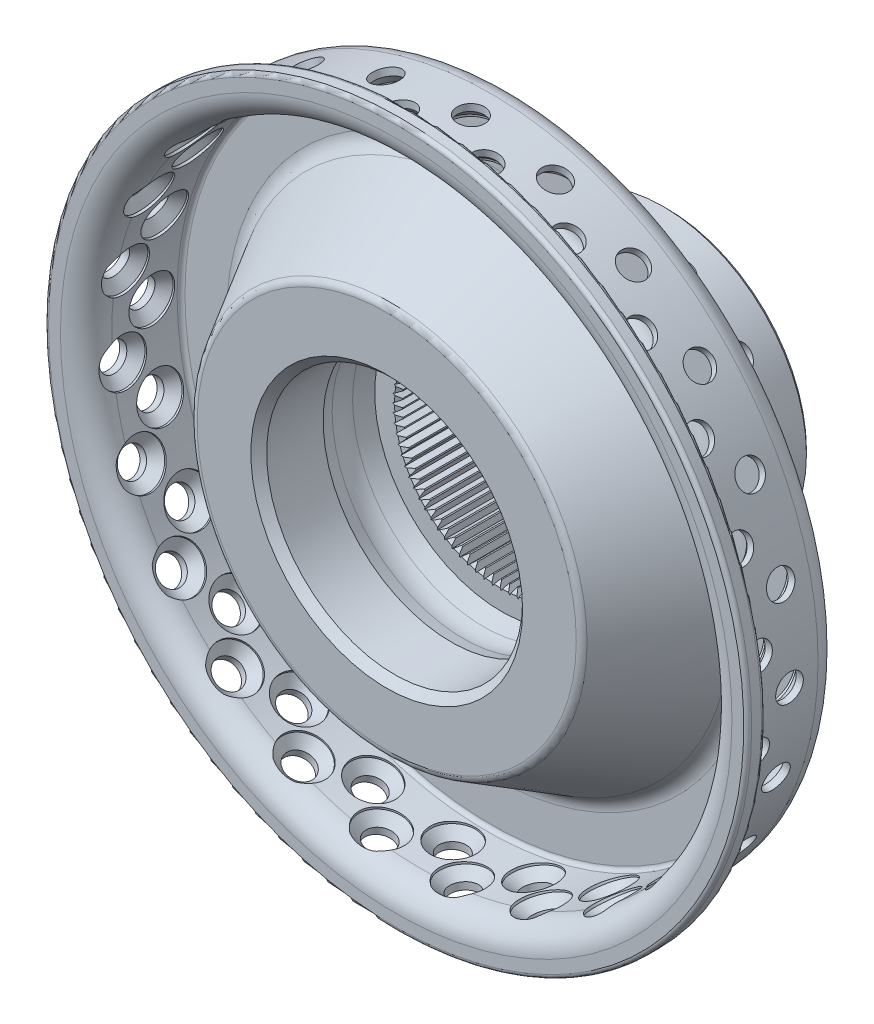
SolidWorks part; units mm, degrees
ref_plane "Front Plane" through (0, 0, 0) normal (0, 0, 1) x (1, 0, 0)
ref_plane "Top Plane" through (0, 0, 0) normal (0, 1, 0) x (1, 0, 0)
ref_plane "Right Plane" through (0, 0, 0) normal (1, 0, 0) x (0, 0, -1)
sketch "Sketch2" plane through (0, 0, 0) normal (1, 0, 0) x (0, 0, -1)
  line L0 (-177.5045, 0) -> (205.9267, 0) construction
  line L1 (0, 185.8166) -> (0, -171.8737) construction
  line L2 (-59.8625, 1430.0214) -> (709.4708, 1430.0214) construction
  line L3 (-280.1871, 421.6397) -> (-279.2316, 640.6377) construction
  line L4 (-37.5584, 109.3943) -> (-37.5584, -109.4755) construction
  dimension "D1" = 219
sketch "Sketch3" plane through (0, 0, 0) normal (1, 0, 0) x (0, 0, -1)
  line L0 (-203.3855, 0) -> (274.712, 0) construction
  line L1 (0, 34.4) -> (0, 47.9879)
  line L2 (0, 185.8166) -> (0, -171.8737) construction
  line L3 (1, 49.7199) -> (24.18, 63.1029)
  line L5 (2.4, 89) -> (2.4, 85)
  line L6 (2.4, 89) -> (6.9, 89)
  line L7 (6.9, 89) -> (6.9, 85)
  line L9 (71, 31) -> (71, 36.26)
  line L11 (0, 34.4) -> (2, 32.4)
  line L12 (2, 32.4) -> (16.3, 32.4)
  line L13 (16.3, 32.4) -> (19.4118, 33.2338)
  line L14 (24.5882, 33.2338) -> (29, 32.0517)
  line L15 (44, 31) -> (71, 31)
  line L26 (37.3465, 36.6007) -> (31.154, 38.26)
  line L28 (25.0819, 52.9193) -> (30.3911, 62.115)
  line L32 (-18.7317, 65) -> (20.4312, 65) construction
  line L33 (0, 0) -> (0, 146.5366) construction
  line L34 (71, 36.26) -> (39.9346, 36.26)
  line L35 (44, 31) -> (44, 26)
  line L36 (44, 26) -> (29, 26)
  line L37 (29, 26) -> (29, 32.0517)
  line L38 (8.9, 83) -> (26.2, 83)
  line L39 (8.9, 78.5) -> (25.43, 78.5)
  line L40 (31.7, 67) -> (31.7, 77.5)
  line L41 (26.43, 67) -> (26.43, 77.5)
  arc A0 (24.18, 63.1029) -> (26.43, 67) centre (21.93, 67) ccw
  arc A1 (30.3911, 62.115) -> (31.7, 67) centre (21.93, 67) ccw
  circle A3 centre (21.93, 67) radius 9.77 construction
  circle A4 centre (21.93, 67) radius 4.5 construction
  arc A7 (19.4118, 33.2338) -> (24.5882, 33.2338) centre (22, 23.5745) cw
  arc A16 (8.9, 83) -> (6.9, 85) centre (8.9, 85) cw
  arc A17 (8.9, 78.5) -> (2.4, 85) centre (8.9, 85) cw
  arc A18 (0, 47.9879) -> (1, 49.7199) centre (2, 47.9879) cw
  arc A19 (37.3465, 36.6007) -> (39.9346, 36.26) centre (39.9346, 46.26) ccw
  arc A20 (26.43, 77.5) -> (25.43, 78.5) centre (25.43, 77.5) ccw
  arc A21 (31.7, 77.5) -> (26.2, 83) centre (26.2, 77.5) ccw
  arc A22 (31.154, 38.26) -> (25.0819, 52.9193) centre (33.7422, 47.9193) cw
  point P16 (25.77, 89)
  point P59 (20.3034, 90.3157)
  point P67 (32.9249, 31)
  point P70 (22, 33.9273)
  point P91 (15, 45)
  point P96 (6.8759, 84.8909)
  point P100 (2.3759, 81.3909)
  point P103 (0, 49.1426)
  dimension "D10" = 166
  dimension "D11" = 9
  dimension "D52" = 2
  dimension "D53" = 6.5
  dimension "D54" = 2
  dimension "D29" = 26
  dimension "D30" = 10
  dimension "D33" = 10
  dimension "D36" = 1
  dimension "D37" = 5.5
  dimension "D6" = 31.0654
  dimension "D20" = 10
  dimension "D1" = 64.8
  dimension "D2" = 65
  dimension "D4" = 6.5543
  dimension "D7" = 22
  dimension "D8" = 2
  dimension "D9" = 178
  dimension "D12" = 2.4
  dimension "D13" = 31.7
  dimension "D14" = 4.5
  dimension "D15" = 75
  dimension "D16" = 60
  dimension "D17" = 16
  dimension "D18" = 5.27
  dimension "D19" = 45
  dimension "D22" = 62
  dimension "D23" = 15
  dimension "D24" = 15
  dimension "D27" = 5.26
  dimension "D28" = 71
  dimension "D31" = 27
  dimension "D32" = 15
  dimension "D34" = 4.5
revolve "Revolve1" add sketch "Sketch3" angle 360 about L0
fillet "Fillet3" radius 2 1 edges at (31, 0, -44)
ref_plane "Plane1" through (0, 0, -10) normal (0, 0, 1) x (1, 0, 0)
ref_plane "Plane2" through (0, 0, -18.5) normal (0, 0, 1) x (1, 0, 0)
ref_plane "Plane3" through (0, 0, -58.5) normal (0, 0, 1) x (1, 0, 0)
ref_plane "Plane4" through (0, 0, -66.3) normal (0, 0, 1) x (1, 0, 0)
sketch "Sketch4" plane through (0, 0, 0) normal (1, 0, 0) x (0, 0, -1)
  line L0 (51, 45.5009) -> (51, 21.7958) construction
  line L1 (47.5, 37.5) -> (47.5, 33.5)
  line L2 (47.5, 33.5) -> (44.5, 30.5)
  line L5 (51, 37.5) -> (47.5, 37.5)
  line L6 (44.5, 30.5) -> (44.5, 29.2972)
  line L7 (44.5, 29.2972) -> (51, 29.2972)
  line L8 (51, 29.2972) -> (51, 37.5)
  point P7 (51, 27.24)
  point P11 (51, 37.3622)
  dimension "D1" = 7
  dimension "D2" = 51
  dimension "D3" = 45
  dimension "D4" = 4
  dimension "D5" = 37.5
  dimension "D6" = 6.5
revolve "Revolve2" add sketch "Sketch4" angle 360 about L0
move or copy body "Body-Move/Copy1" bodies to move or copy 122 copy yes number of copies 1 translate (0, 0, -9)
move or copy body "Body-Move/Copy2" bodies to move or copy 122 copy no rotation origin (0, 0, 0) rotation axis (0, 0, -1) rotation angle 15
move or copy body "Body-Move/Copy5" bodies to move or copy 223 123 copy no rotation origin (0, 0, 0) rotation axis (0, 0, 1) rotation angle 7.5
pattern_circular "CirPattern2" count 12 over 360 about axis through (0, 0, 0) along (0, 0, 1)
combine bodies "Combine2" bodies to combine 101 225 153 155 157 159 161 163 148 165 150 167 152 169 154 156 158 160 162 224 164 149 166 151 168
sketch "Sketch5" plane through (0, 0, 0) normal (1, 0, 0) x (0, 0, -1)
  line L0 (11.5, 109.5301) -> (11.5, 78.9) construction
  line L2 (8, 84.2) -> (8, 81.2)
  line L4 (8, 81.2) -> (5.7, 78.9)
  line L5 (5.7, 78.9) -> (11.5, 78.9) construction
  line L6 (11.5, 75.867) -> (11.5, 84.2)
  line L7 (11.5, 84.2) -> (8, 84.2)
  line L8 (5.7, 78.9) -> (5.7, 75.867)
  line L9 (5.7, 75.867) -> (11.5, 75.867)
  dimension "D1" = 7
  dimension "D2" = 45
  dimension "D3" = 11.5
  dimension "D4" = 3
  dimension "D5" = 5.8
  dimension "D6" = 84.2
revolve "Revolve3" add sketch "Sketch5" angle 360 about L0
move or copy body "Body-Move/Copy3" bodies to move or copy 171 copy yes number of copies 1 translate (0, 0, -7.5)
move or copy body "Body-Move/Copy4" bodies to move or copy 172 copy no rotation origin (0, 0, 0) rotation axis (0, 0, -1) rotation angle 7.2
move or copy body "Body-Move/Copy6" bodies to move or copy 173 171 copy no rotation origin (0, 0, 0) rotation axis (0, 0, 1) rotation angle 3.6
move or copy body "Body-Move/Copy7" bodies to move or copy 226 227 copy no rotation origin (0, 0, 0) rotation axis (0, 0, 1) rotation angle 2
pattern_circular "CirPattern3" count 24 over 360 about axis through (0, 0, 0) along (0, 0, 1)
combine bodies "Combine3" bodies to combine 170 229 228 174 175 176 177 178 179 180 181 182 183 184 185 186 187 188 189 190 191 192 193 194 195 196 198 199 200 201 202 203 204 205 206 207 208 209 210 211
chamfer "Chamfer1" distance 1 angle 45 2 edges at (26, 0, -29) (26, 0, -44)
fillet "Fillet2" radius 1 2 edges at (89, 0, -2.4) (89, 0, -6.9)
chamfer "Chamfer2" distance 1 angle 45 2 edges at (31, 0, -71) (36.26, 0, -71)
sketch "Sketch9" plane through (0, 0, -44) normal (0, 0, -1) x (-1, 0, 0)
  line L0 (0, 0) -> (0, 43.2229) construction
  line L1 (-1.4777, 24.9406) -> (0, 27.5)
  line L2 (0, 27.5) -> (1.4777, 24.9406)
  line L3 (1.4777, 24.9406) -> (-1.4777, 24.9406)
  line L4 (0, 26) -> (8.0651, 26) construction
  circle A0 centre (0, 0) radius 26 construction
  dimension "D1" = 1.5
extrude "Cut-Extrude1" cut sketch "Sketch9" against normal blind 25
pattern_circular "CirPattern4" count 80 over 360 about axis through (0, 0, 0) along (0, 0, 1) of "Cut-Extrude1"
